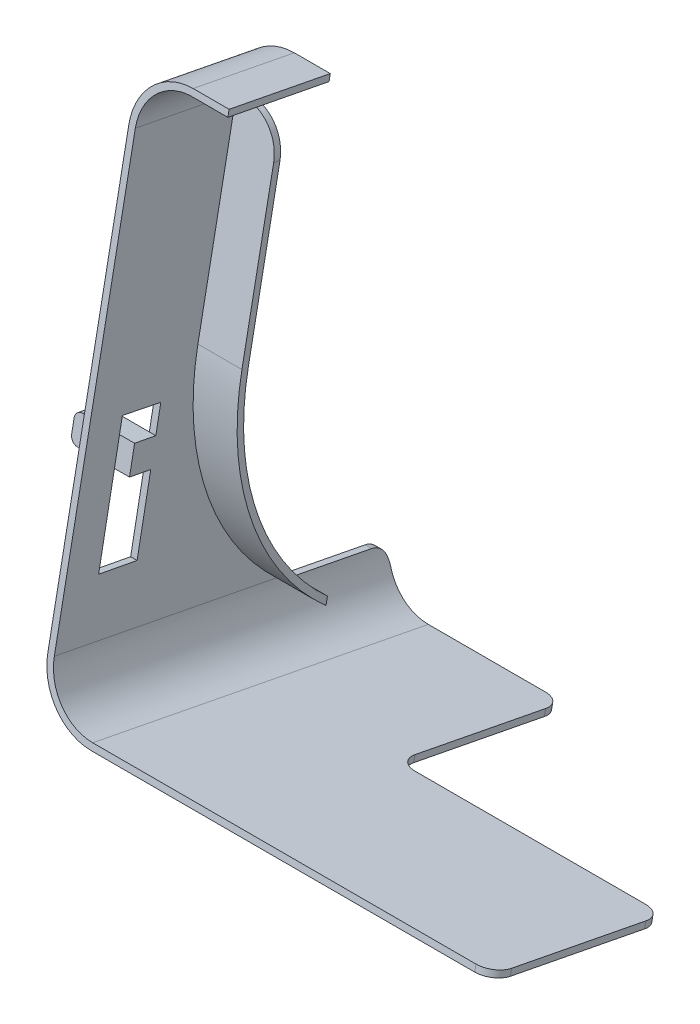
SolidWorks part; units mm, degrees
ref_plane "Front" through (0, 0, 0) normal (0, 0, 1) x (1, 0, 0)
ref_plane "Top" through (0, 0, 0) normal (0, 1, 0) x (1, 0, 0)
ref_plane "Right" through (0, 0, 0) normal (1, 0, 0) x (0, 0, -1)
imported_body "Imported1"
sketch "Sketch1" plane through (-909.8832, 0, 0) normal (-1, 0, 0) x (0, 0, 1)
  line L0 (-365.7486, -507.5599) -> (-374.139, -463.2266)
  line L1 (-365.7486, -507.5599) -> (-379.3402, -510.1322)
  line L2 (-379.3402, -510.1322) -> (-387.695, -465.9869)
  line L3 (-374.139, -463.2266) -> (-387.695, -465.9869)
extrude "Cut-Extrude1" cut sketch "Sketch1" against normal through all
sketch "Sketch2" plane through (0, -86.9502, -459.4302) normal (0, 0.186, 0.9826) x (1, 0, 0)
  line L0 (-907.5972, -404.8583) -> (-907.5972, -395.2365)
  line L2 (-907.5972, -430.6941) -> (-907.5972, -385.7651) construction
  line L3 (-907.5972, -395.2365) -> (-925.9409, -395.2365)
  line L4 (-928.4809, -397.7765) -> (-928.4809, -402.3183)
  line L5 (-925.9409, -404.8583) -> (-907.5972, -404.8583)
  arc A0 (-928.4809, -402.3183) -> (-925.9409, -404.8583) centre (-925.9409, -402.3183) ccw
  arc A1 (-925.9409, -395.2365) -> (-928.4809, -397.7765) centre (-925.9409, -397.7765) ccw
  circle A2 centre (-920.2074, -400.2592) radius 2.9028
  dimension "D1" = 2.54
extrude "Extrude1" add sketch "Sketch2" along normal blind 7.62
